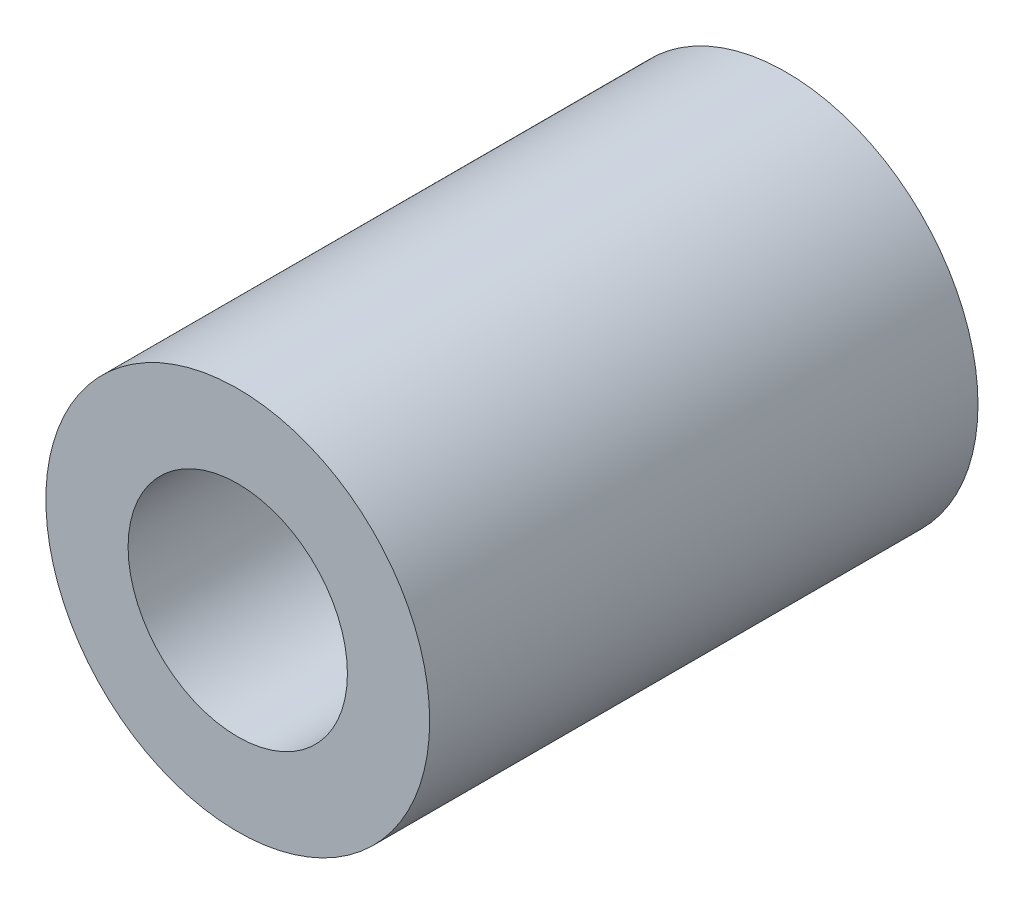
SolidWorks part; units mm, degrees
ref_plane "Plan de face" through (0, 0, 0) normal (0, 0, 1) x (1, 0, 0)
ref_plane "Plan de dessus" through (0, 0, 0) normal (0, 1, 0) x (1, 0, 0)
ref_plane "Plan de droite" through (0, 0, 0) normal (1, 0, 0) x (0, 0, -1)
sketch "Esquisse1" plane through (0, 0, 0) normal (0, 0, 1) x (1, 0, 0)
  circle A0 centre (0, 0) radius 2
  circle A1 centre (0, 0) radius 3.5
  dimension "D1" = 4
  dimension "D2" = 7
extrude "Boss.-Extru.1" add sketch "Esquisse1" along normal blind 10
